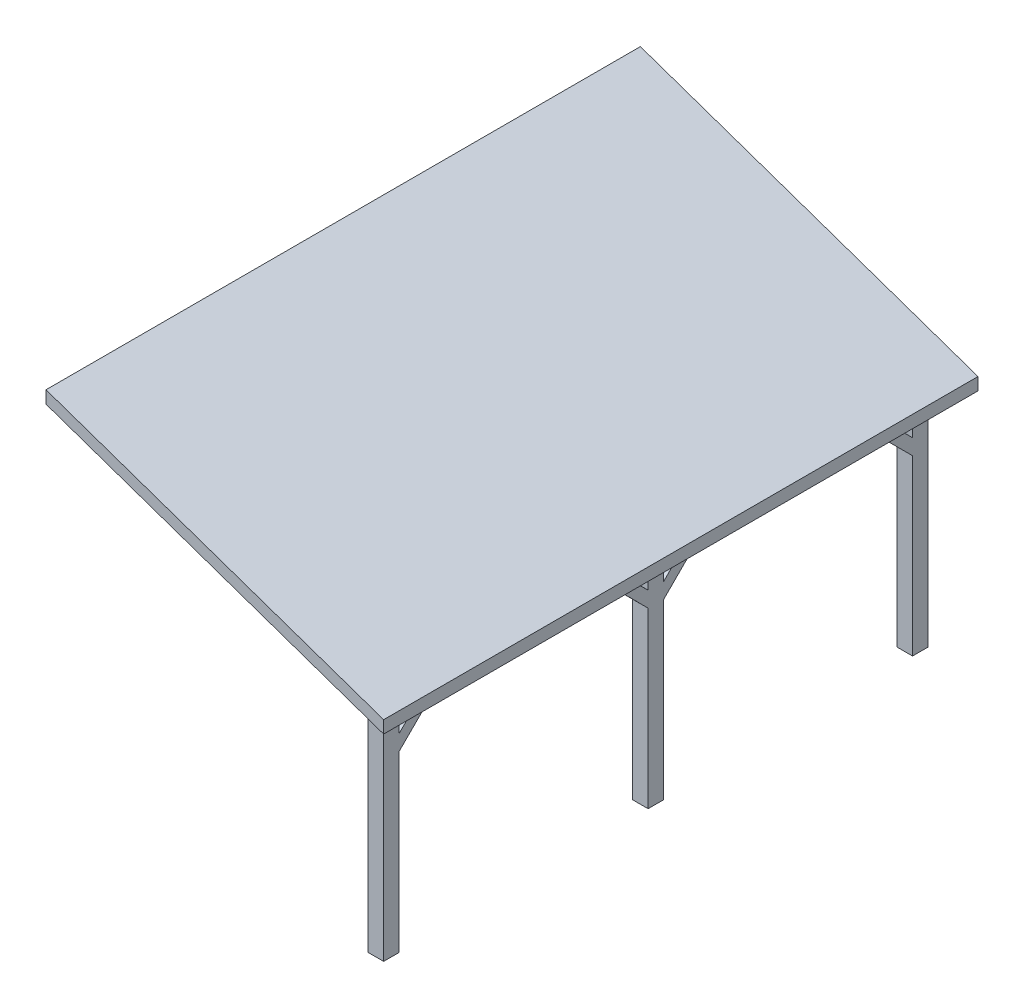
SolidWorks part; units mm, degrees
ref_plane "Plan de face" through (0, 0, 0) normal (0, 0, 1) x (1, 0, 0)
ref_plane "Plan de dessus" through (0, 0, 0) normal (0, 1, 0) x (1, 0, 0)
ref_plane "Plan de droite" through (0, 0, 0) normal (1, 0, 0) x (0, 0, -1)
sketch "Esquisse1" plane through (0, 0, 0) normal (0, 0, 1) x (1, 0, 0)
  line L0 (0, 0) -> (0, 22.53)
  line L1 (0, 22.53) -> (21.66, 15.03)
  line L2 (21.66, 15.03) -> (21.66, 0)
  line L3 (21.66, 0) -> (0, 0)
  dimension "D1" = 22.53
  dimension "D2" = 15.03
  dimension "D3" = 21.66
extrude "Extrusion2" add sketch "Esquisse1" along normal blind 38.13
sketch "Esquisse2" plane through (0, 0, 38.13) normal (0, 0, 1) x (1, 0, 0)
  line L0 (0, 0) -> (0, 21.73)
  line L1 (0, 22.53) -> (0, 0) construction
  line L2 (0, 21.73) -> (19.06, 15.1303)
  line L3 (19.06, 15.1303) -> (19.06, 0)
  line L4 (0, 0) -> (21.66, 0) construction
  line L5 (19.06, 0) -> (0, 0)
  line L6 (20.06, 0) -> (20.06, 14.784)
  line L7 (20.06, 14.784) -> (21.66, 14.23)
  line L8 (21.66, 0) -> (21.66, 15.03) construction
  line L9 (21.66, 14.23) -> (21.66, 0)
  line L10 (21.66, 0) -> (20.06, 0)
  dimension "D1" = 1.6
  dimension "D2" = 1
  dimension "D3" = 0.8
  dimension "D4" = 0.8
extrude "Enlèv. mat.-Extru.1" cut sketch "Esquisse2" against normal through all
sketch "Esquisse3" plane through (0, 0, 38.13) normal (0, 0, 1) x (1, 0, 0)
  line L0 (19.06, 15.1303) -> (20.06, 14.784)
  line L1 (20.06, 14.784) -> (20.06, 0)
  line L2 (20.06, 0) -> (19.06, 0)
  line L3 (19.06, 0) -> (19.06, 15.1303)
extrude "Enlèv. mat.-Extru.2" cut sketch "Esquisse3" against normal blind 1.6
sketch "Esquisse4" plane through (0, 0, 0) normal (0, 0, -1) x (-1, 0, 0)
  line L0 (-20.06, 0) -> (-20.06, 14.784)
  line L1 (-20.06, 14.784) -> (-19.06, 15.1303)
  line L2 (-19.06, 15.1303) -> (-19.06, 0)
  line L3 (-19.06, 0) -> (-20.06, 0)
extrude "Enlèv. mat.-Extru.3" cut sketch "Esquisse4" against normal blind 1.6
sketch "Esquisse5" plane through (19.06, 0, 0) normal (-1, 0, 0) x (0, 0, 1)
  line L0 (2.6, 0) -> (2.6, 11.1303)
  line L1 (1.6, 0) -> (36.53, 0) construction
  line L2 (2.6, 11.1303) -> (5.6, 14.1303)
  line L3 (5.6, 14.1303) -> (15.565, 14.1303)
  line L4 (15.565, 14.1303) -> (18.565, 11.1303)
  line L5 (18.565, 11.1303) -> (18.565, 0)
  line L6 (18.565, 0) -> (2.6, 0)
  line L7 (1.6, 15.1303) -> (36.53, 15.1303) construction
  line L8 (1.6, 0) -> (1.6, 15.1303) construction
  dimension "D1" = 1
  dimension "D2" = 15.965
  dimension "D3" = 1
  dimension "D4" = 3
  dimension "D5" = 4
  dimension "D6" = 4
extrude "Enlèv. mat.-Extru.4" cut sketch "Esquisse5" against normal up to next
sketch "Esquisse6" plane through (19.06, 0, 0) normal (-1, 0, 0) x (0, 0, 1)
  line L0 (19.565, 0) -> (19.565, 11.1431)
  line L1 (18.565, 0) -> (36.53, 0) construction
  line L2 (19.565, 11.1431) -> (22.565, 14.1606)
  line L3 (22.565, 14.1606) -> (32.53, 14.1606)
  line L4 (32.53, 14.1606) -> (35.53, 11.1779)
  line L5 (35.53, 11.1779) -> (35.53, 0)
  line L6 (35.53, 0) -> (19.565, 0)
  dimension "D1" = 1
  dimension "D2" = 1
  dimension "D3" = 3
  dimension "D4" = 3
extrude "Enlèv. mat.-Extru.5" cut sketch "Esquisse6" against normal blind 1
sketch "Esquisse7" plane through (19.06, 0, 0) normal (-1, 0, 0) x (0, 0, 1)
  line L0 (2.6, 12.1303) -> (4.6, 14.1303)
  line L1 (4.6, 14.1303) -> (2.6, 14.1303)
  line L2 (2.6, 14.1303) -> (2.6, 12.1303)
  line L4 (1.6, 15.1303) -> (36.53, 15.1303) construction
  line L5 (1.6, 0) -> (1.6, 15.1303) construction
  dimension "D1" = 1
  dimension "D2" = 1
  dimension "D3" = 1
  dimension "D4" = 1
extrude "Enlèv. mat.-Extru.6" cut sketch "Esquisse7" against normal blind 1
sketch "Esquisse8" plane through (19.06, 0, 0) normal (-1, 0, 0) x (0, 0, 1)
  line L0 (16.565, 14.1303) -> (18.565, 14.1303)
  line L1 (18.565, 14.1303) -> (18.565, 12.1303)
  line L2 (18.565, 12.1303) -> (16.565, 14.1303)
  line L3 (1.6, 15.1303) -> (36.53, 15.1303) construction
  line L5 (19.565, 11.1431) -> (19.565, 0) construction
  dimension "D1" = 1
  dimension "D2" = 1
  dimension "D3" = 1
  dimension "D4" = 1
extrude "Enlèv. mat.-Extru.7" cut sketch "Esquisse8" against normal blind 1
sketch "Esquisse9" plane through (19.06, 0, 0) normal (-1, 0, 0) x (0, 0, 1)
  line L0 (19.565, 12.1431) -> (19.565, 14.1303)
  line L1 (19.565, 14.1303) -> (21.565, 14.1303)
  line L2 (21.565, 14.1303) -> (19.565, 12.1431)
  line L3 (1.6, 15.1303) -> (36.53, 15.1303) construction
  dimension "D1" = 1
  dimension "D2" = 1
  dimension "D3" = 1
  dimension "D4" = 1
extrude "Enlèv. mat.-Extru.8" cut sketch "Esquisse9" against normal blind 1
sketch "Esquisse10" plane through (19.06, 0, 0) normal (-1, 0, 0) x (0, 0, 1)
  line L0 (33.53, 14.1303) -> (35.53, 14.1303)
  line L1 (35.53, 14.1303) -> (35.53, 12.1779)
  line L2 (35.53, 12.1779) -> (33.53, 14.1303)
  line L3 (36.53, 15.1303) -> (36.53, 0) construction
  line L4 (1.6, 15.1303) -> (36.53, 15.1303) construction
  dimension "D1" = 1
  dimension "D2" = 1
  dimension "D3" = 1
  dimension "D4" = 1
extrude "Enlèv. mat.-Extru.9" cut sketch "Esquisse10" against normal blind 1
